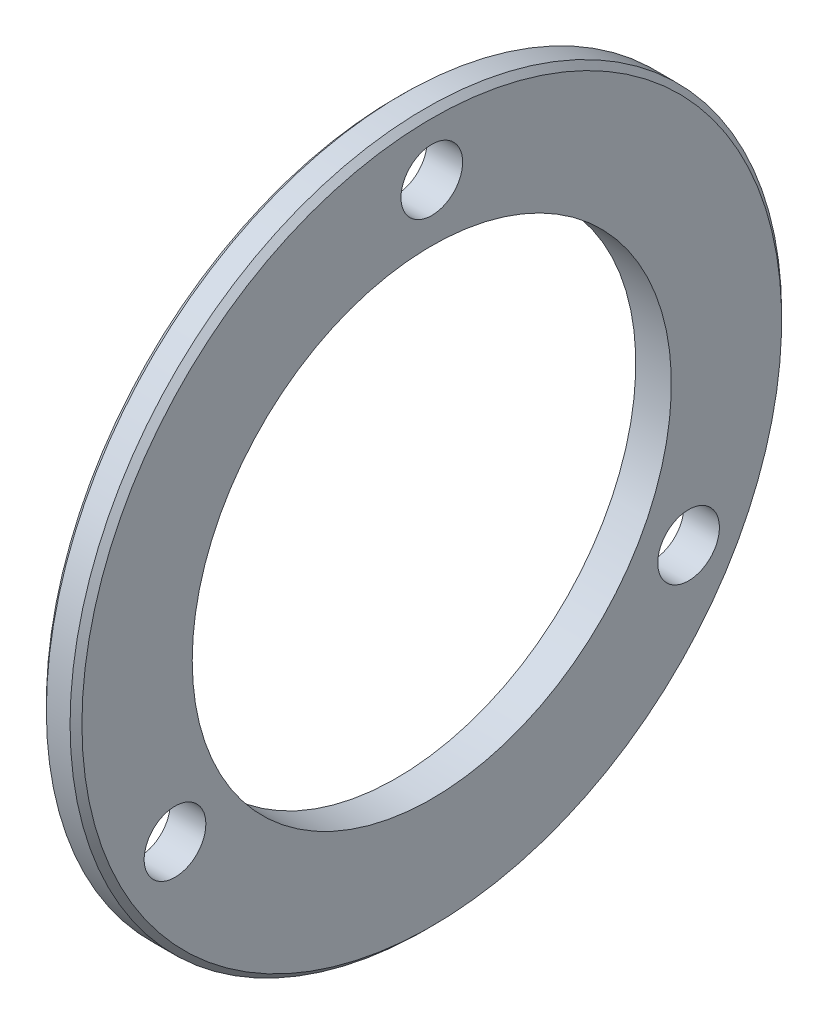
SolidWorks part; units mm, degrees
ref_plane "Vorne" through (0, 0, 0) normal (0, 0, 1) x (1, 0, 0)
ref_plane "Oben" through (0, 0, 0) normal (0, 1, 0) x (1, 0, 0)
ref_plane "Rechts" through (0, 0, 0) normal (1, 0, 0) x (0, 0, -1)
sketch "Skizze1" plane through (0, 0, 0) normal (0, 0, 1) x (1, 0, 0)
  line L0 (0, 0) -> (27.5438, 0) construction
  line L2 (0, 30) -> (3, 30)
  line L3 (0, 30) -> (0, 20.2)
  line L4 (0, 20.2) -> (3, 20.2)
  line L5 (3, 30) -> (3, 20.2)
  dimension "D1" = 40.4
  dimension "D2" = 60
  dimension "D3" = 3
revolve "Rotation1" add sketch "Skizze1" angle 360 about L0
hole_wizard "Ø5.2 (5.2) Durchmesser Bohrung1" positions "Skizze3" profile "Skizze4" hole size "Ø5.2" standard "ISO"
sketch "Skizze3" plane through (3, 0, 0) normal (1, 0, 0) x (0, 0, -1)
  point P1 (0, 25)
  dimension "D1" = 25
sketch "Skizze4" plane through (3, 25, 0) normal (0, 1, 0) x (0, 0, -1)
  line L0 (0, 0) -> (0, 3)
  line L1 (0, 3) -> (2.6, 3)
  line L2 (2.6, 3) -> (2.6, 0)
  line L5 (2.6, 0) -> (0, 0)
  line L11 (0, -6.35) -> (0, 107.95) construction
  dimension "Bohrerdurchmesser" = 5.2
  dimension "Bohrungstiefe" = 3
pattern_circular "Kreismuster1" count 3 over 360 about axis through (0, 0, 0) along (1, 0, 0) of "Ø5.2 (5.2) Durchmesser Bohrung1"
chamfer "Fase1" distance 0.5 angle 45 2 edges at (0, 0, 30) (3, 0, 30)
